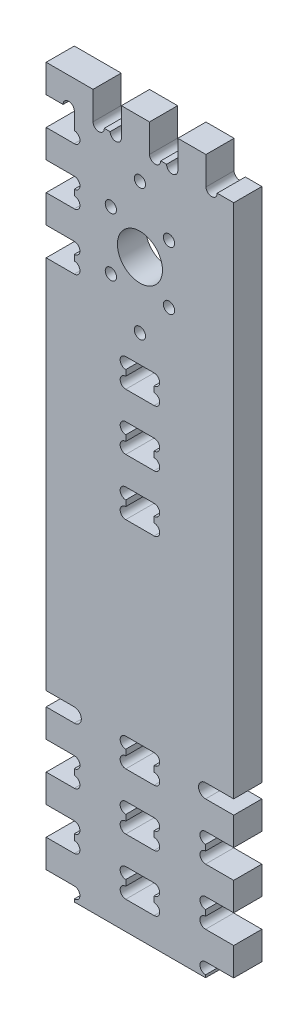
SolidWorks part; units mm, degrees
ref_plane "Ebene vorne" through (0, 0, 0) normal (0, 0, 1) x (1, 0, 0)
ref_plane "Ebene oben" through (0, 0, 0) normal (0, 1, 0) x (1, 0, 0)
ref_plane "Ebene rechts" through (0, 0, 0) normal (1, 0, 0) x (0, 0, -1)
sketch "Skizze1" plane through (0, 0, 0) normal (0, 0, 1) x (1, 0, 0)
  line L0 (0, 82.6) -> (15, 82.6)
  line L1 (0, 365.2705) -> (9, 365.2705)
  line L5 (0, 82.6) -> (0, 67.6)
  line L6 (0, 67.6) -> (15, 67.6)
  line L7 (15, 61.6) -> (15, 58.5)
  line L8 (15, 52.5) -> (0, 52.5)
  line L9 (0, 52.5) -> (0, 37.5)
  line L10 (0, 37.5) -> (15, 37.5)
  line L11 (15, 31.5) -> (15, 28.4)
  line L13 (0, 22.4) -> (0, 7.4)
  line L14 (15, 22.4) -> (0, 22.4)
  line L15 (0, 7.4) -> (15, 7.4)
  line L16 (85, 90.1) -> (100, 90.1)
  line L17 (85, 82.6) -> (100, 82.6)
  line L18 (100, 67.6) -> (85, 67.6)
  line L19 (85, 61.6) -> (85, 58.5)
  line L20 (85, 52.5) -> (100, 52.5)
  line L21 (100, 52.5) -> (100, 37.5)
  line L22 (100, 37.5) -> (85, 37.5)
  line L23 (85, 31.5) -> (85, 28.4)
  line L24 (100, 82.6) -> (100, 67.6)
  line L25 (85, 22.4) -> (100, 22.4)
  line L26 (100, 7.4) -> (85, 7.4)
  line L27 (100, 22.4) -> (100, 7.4)
  line L29 (15, 1.4) -> (15, 0)
  line L30 (85, 1.4) -> (85, 0)
  line L31 (85, 0) -> (15, 0)
  line L32 (0, 289.9705) -> (0, 90.1)
  line L33 (0, 90.1) -> (15, 90.1)
  line L34 (100, 90.1) -> (100, 365.4)
  line L35 (15, 295.9705) -> (15, 299.0705)
  line L36 (15, 350.1705) -> (0, 350.1705)
  line L37 (0, 305.0705) -> (0, 320.0705)
  line L39 (15, 326.0705) -> (15, 329.1705)
  line L40 (0, 335.1705) -> (15, 335.1705)
  line L41 (0, 335.1705) -> (0, 350.1705)
  line L42 (15, 320.0705) -> (0, 320.0705)
  line L43 (15, 356.1705) -> (15, 365.2705)
  line L44 (0, 305.0705) -> (15, 305.0705)
  line L45 (0, 365.2705) -> (0, 380.2705)
  line L46 (0, 380.2705) -> (25, 380.2705)
  line L47 (31, 365.2705) -> (34.1, 365.2705)
  line L48 (40.1, 365.2705) -> (40.1, 380.2705)
  line L49 (55.1, 380.2705) -> (55.1, 365.2705)
  line L50 (40.1, 380.2705) -> (55.1, 380.2705)
  line L51 (61.1, 365.2705) -> (64.2, 365.2705)
  line L52 (70.2, 365.2705) -> (70.2, 380.2705)
  line L53 (85.2, 380.2705) -> (85.2, 365.2705)
  line L54 (70.2, 380.2705) -> (85.2, 380.2705)
  line L55 (91.2, 365.4) -> (100, 365.4)
  line L56 (25, 365.2705) -> (25, 380.2705)
  line L57 (15, 289.9705) -> (0, 289.9705)
  arc A0 (15, 67.6) -> (15, 61.6) centre (15, 64.6) cw
  arc A1 (15, 58.5) -> (15, 52.5) centre (15, 55.5) cw
  arc A2 (15, 37.5) -> (15, 31.5) centre (15, 34.5) cw
  arc A3 (15, 28.4) -> (15, 22.4) centre (15, 25.4) cw
  arc A4 (15, 7.4) -> (15, 1.4) centre (15, 4.4) cw
  arc A5 (85, 7.4) -> (85, 1.4) centre (85, 4.4) ccw
  arc A6 (85, 22.4) -> (85, 28.4) centre (85, 25.4) cw
  arc A7 (85, 31.5) -> (85, 37.5) centre (85, 34.5) cw
  arc A8 (85, 52.5) -> (85, 58.5) centre (85, 55.5) cw
  arc A9 (85, 61.6) -> (85, 67.6) centre (85, 64.6) cw
  arc A10 (15, 82.6) -> (15, 90.1) centre (15, 86.35) ccw
  arc A11 (85, 82.6) -> (85, 90.1) centre (85, 86.35) cw
  arc A12 (15, 365.2705) -> (9, 365.2705) centre (12, 365.2705) ccw
  arc A13 (15, 356.1705) -> (15, 350.1705) centre (15, 353.1705) cw
  arc A14 (15, 335.1705) -> (15, 329.1705) centre (15, 332.1705) cw
  arc A15 (15, 326.0705) -> (15, 320.0705) centre (15, 323.0705) cw
  arc A16 (15, 305.0705) -> (15, 299.0705) centre (15, 302.0705) cw
  arc A17 (15, 295.9705) -> (15, 289.9705) centre (15, 292.9705) cw
  arc A18 (91.2, 365.4) -> (85.2, 365.2705) centre (88.2, 365.3353) cw
  arc A19 (70.2, 365.2705) -> (64.2, 365.2705) centre (67.2, 365.2705) cw
  arc A20 (61.1, 365.2705) -> (55.1, 365.2705) centre (58.1, 365.2705) cw
  arc A21 (40.1, 365.2705) -> (34.1, 365.2705) centre (37.1, 365.2705) cw
  arc A22 (31, 365.2705) -> (25, 365.2705) centre (28, 365.2705) cw
  dimension "D13" = 15.1
  dimension "D14" = 100
  dimension "D15" = 7.5
  dimension "D16" = 15
  dimension "D17" = 290.1705
  dimension "D18" = 15.1
  dimension "D12" = 15.1
  dimension "D19" = 7.5
  dimension "D20" = 15
  dimension "D21" = 15
  dimension "D22" = 15
  dimension "D23" = 15.1
  dimension "D36" = 6
  dimension "D37" = 6
  dimension "D38" = 6
  dimension "D39" = 3.1
  dimension "D40" = 6
  dimension "D41" = 6
  dimension "D6" = 15
  dimension "D7" = 15.1
  dimension "D8" = 15.1
  dimension "D9" = 15
  dimension "D10" = 7.4
  dimension "D11" = 15
  dimension "D24" = 9
  dimension "D25" = 9.1
  dimension "D26" = 15
  dimension "D27" = 15
  dimension "D28" = 3.1
  dimension "D29" = 15
  dimension "D30" = 15
  dimension "D31" = 15
  dimension "D32" = 6
  dimension "D33" = 100
  dimension "D34" = 6
  dimension "D35" = 15
  dimension "D47" = 15
  dimension "D49" = 15
  dimension "D50" = 15
  dimension "D51" = 15
  dimension "D52" = 15
  dimension "D53" = 6
  dimension "D54" = 15
  dimension "D55" = 6
  dimension "D56" = 15
  dimension "D57" = 15
  dimension "D58" = 15
  dimension "D59" = 6
  dimension "D60" = 15.1
  dimension "D61" = 15.1
  dimension "D62" = 7.4
  dimension "D63" = 15
  dimension "D64" = 15
  dimension "D65" = 15
  dimension "D66" = 6
  dimension "D67" = 6
  dimension "D68" = 6
  dimension "D69" = 6
  dimension "D70" = 6
  dimension "D71" = 6
  dimension "D72" = 6
  dimension "D73" = 15
extrude "Aufsatz-Linear austragen1" add sketch "Skizze1" along normal blind 15
sketch "Skizze2" plane through (0, 0, 0) normal (0, 0, -1) x (-1, 0, 0)
  line L0 (-100, 90.1) -> (-100, 365.4) construction
  line L1 (-61.1, 365.2705) -> (-64.2, 365.2705) construction
  circle A0 centre (-50, 350.2705) radius 5.05
  circle A1 centre (-50, 280.2705) radius 5.05
  dimension "D1" = 10.1
  dimension "D2" = 10.1
  dimension "D3" = 50
  dimension "D4" = 70
  dimension "D5" = 15
extrude "Schnitt-Linear austragen2" cut sketch "Skizze2" against normal blind 7.5
sketch "Skizze3" plane through (0, 0, 0) normal (0, 0, -1) x (-1, 0, 0)
  line L0 (-100, 90.1) -> (-100, 365.4) construction
  circle A0 centre (-50, 315.2705) radius 12
  circle A1 centre (-50, 350.2705) radius 5.05 construction
  circle A2 centre (-50, 350.2705) radius 3
  circle A3 centre (-65.5, 330.7705) radius 3
  circle A4 centre (-34.5, 330.7705) radius 3
  circle A5 centre (-34.5, 299.7705) radius 3
  circle A6 centre (-65.5, 299.7705) radius 3
  circle A7 centre (-50, 280.2705) radius 3
  dimension "D1" = 35
  dimension "D2" = 24
  dimension "D3" = 50
  dimension "D4" = 6
  dimension "D5" = 6
  dimension "D6" = 6
  dimension "D7" = 6
  dimension "D13" = 6
  dimension "D14" = 6
  dimension "D8" = 31
  dimension "D9" = 31
  dimension "D10" = 31
  dimension "D11" = 15.5
  dimension "D12" = 15.5
extrude "Schnitt-Linear austragen3" cut sketch "Skizze3" against normal blind 17.5
sketch "Skizze5" plane through (0, 0, 15) normal (0, 0, 1) x (1, 0, 0)
  line L0 (42.45, 45.1) -> (57.55, 45.1)
  line L1 (57.55, 51.1) -> (57.55, 54.2)
  line L2 (42.45, 15) -> (57.55, 15)
  line L3 (57.55, 21) -> (57.55, 24.1)
  line L4 (0, 22.4) -> (0, 7.4) construction
  line L5 (85, 0) -> (15, 0) construction
  line L6 (85, 31.5) -> (85, 28.4) construction
  line L7 (15, 31.5) -> (15, 28.4) construction
  line L8 (42.45, 24.1) -> (42.45, 21)
  line L9 (42.45, 30.1) -> (57.55, 30.1)
  line L10 (15, 0) -> (85, 0) construction
  line L11 (42.45, 54.2) -> (42.45, 51.1)
  line L12 (42.45, 60.2) -> (57.55, 60.2)
  line L13 (42.45, 75.2) -> (57.55, 75.2)
  line L14 (57.55, 81.2) -> (57.55, 84.3)
  line L15 (42.45, 84.3) -> (42.45, 81.2)
  line L16 (42.45, 90.3) -> (57.55, 90.3)
  line L17 (42.45, 220.4) -> (57.55, 220.4)
  line L18 (57.55, 226.4) -> (57.55, 229.5)
  line L19 (42.45, 190.3) -> (57.55, 190.3)
  line L20 (57.55, 196.3) -> (57.55, 199.4)
  line L21 (42.45, 199.4) -> (42.45, 196.3)
  line L22 (42.45, 205.4) -> (57.55, 205.4)
  line L23 (42.45, 229.5) -> (42.45, 226.4)
  line L24 (42.45, 235.5) -> (57.55, 235.5)
  line L25 (42.45, 250.5) -> (57.55, 250.5)
  line L26 (57.55, 256.5) -> (57.55, 259.6)
  line L27 (42.45, 259.6) -> (42.45, 256.5)
  line L28 (42.45, 265.6) -> (57.55, 265.6)
  arc A0 (57.55, 30.1) -> (57.55, 24.1) centre (57.55, 27.1) cw
  arc A1 (57.55, 21) -> (57.55, 15) centre (57.55, 18) cw
  arc A2 (42.45, 21) -> (42.45, 15) centre (42.45, 18) ccw
  arc A3 (42.45, 24.1) -> (42.45, 30.1) centre (42.45, 27.1) cw
  arc A4 (57.55, 60.2) -> (57.55, 54.2) centre (57.55, 57.2) cw
  arc A5 (57.55, 51.1) -> (57.55, 45.1) centre (57.55, 48.1) cw
  arc A6 (42.45, 51.1) -> (42.45, 45.1) centre (42.45, 48.1) ccw
  arc A7 (42.45, 54.2) -> (42.45, 60.2) centre (42.45, 57.2) cw
  arc A8 (57.55, 90.3) -> (57.55, 84.3) centre (57.55, 87.3) cw
  arc A9 (57.55, 81.2) -> (57.55, 75.2) centre (57.55, 78.2) cw
  arc A10 (42.45, 81.2) -> (42.45, 75.2) centre (42.45, 78.2) ccw
  arc A11 (42.45, 84.3) -> (42.45, 90.3) centre (42.45, 87.3) cw
  arc A12 (57.55, 205.4) -> (57.55, 199.4) centre (57.55, 202.4) cw
  arc A13 (57.55, 196.3) -> (57.55, 190.3) centre (57.55, 193.3) cw
  arc A14 (42.45, 196.3) -> (42.45, 190.3) centre (42.45, 193.3) ccw
  arc A15 (42.45, 199.4) -> (42.45, 205.4) centre (42.45, 202.4) cw
  arc A16 (57.55, 235.5) -> (57.55, 229.5) centre (57.55, 232.5) cw
  arc A17 (57.55, 226.4) -> (57.55, 220.4) centre (57.55, 223.4) cw
  arc A18 (42.45, 226.4) -> (42.45, 220.4) centre (42.45, 223.4) ccw
  arc A19 (42.45, 229.5) -> (42.45, 235.5) centre (42.45, 232.5) cw
  arc A20 (57.55, 265.6) -> (57.55, 259.6) centre (57.55, 262.6) cw
  arc A21 (57.55, 256.5) -> (57.55, 250.5) centre (57.55, 253.5) cw
  arc A22 (42.45, 256.5) -> (42.45, 250.5) centre (42.45, 253.5) ccw
  arc A23 (42.45, 259.6) -> (42.45, 265.6) centre (42.45, 262.6) cw
  dimension "D2" = 27.45
  dimension "D3" = 27.45
  dimension "D4" = 15.1
  dimension "D9" = 15.1
  dimension "D10" = 15.1
  dimension "D11" = 15.1
  dimension "D19" = 3.1
  dimension "D20" = 6
  dimension "D14" = 3.1
  dimension "D16" = 15.1
  dimension "D17" = 0
  dimension "D22" = 15.1
  dimension "D24" = 15.1
  dimension "D29" = 6
  dimension "D30" = 15.1
  dimension "D35" = 0
  dimension "D37" = 3.1
  dimension "D41" = 15.1
  dimension "D46" = 6
  dimension "D50" = 15.1
  dimension "D55" = 6
  dimension "D60" = 100
  dimension "D5" = 15
  dimension "D6" = 15.1
  dimension "D8" = 15.1
  dimension "D12" = 0
  dimension "D13" = 15.1
  dimension "D15" = 3.1
  dimension "D18" = 3.1
  dimension "D21" = 6
  dimension "D23" = 15.1
  dimension "D25" = 0
  dimension "D26" = 3.1
  dimension "D27" = 3.1
  dimension "D28" = 6
  dimension "D31" = 15.1
  dimension "D32" = 15
  dimension "D33" = 15
  dimension "D34" = 15.1
  dimension "D36" = 3.1
  dimension "D38" = 6
  dimension "D39" = 6
  dimension "D40" = 15.1
  dimension "D42" = 15.1
  dimension "D43" = 0
  dimension "D44" = 3.1
  dimension "D45" = 3.1
  dimension "D47" = 6
  dimension "D48" = 15.1
  dimension "D49" = 15.1
  dimension "D51" = 0
  dimension "D52" = 3.1
  dimension "D53" = 3.1
  dimension "D54" = 6
  dimension "D56" = 15.1
  dimension "D57" = 15.1
  dimension "D58" = 15
  dimension "D59" = 15
  dimension "D70" = 6
  dimension "D72" = 6
extrude "Schnitt-Linear austragen5" cut sketch "Skizze5" against normal blind 17.5
